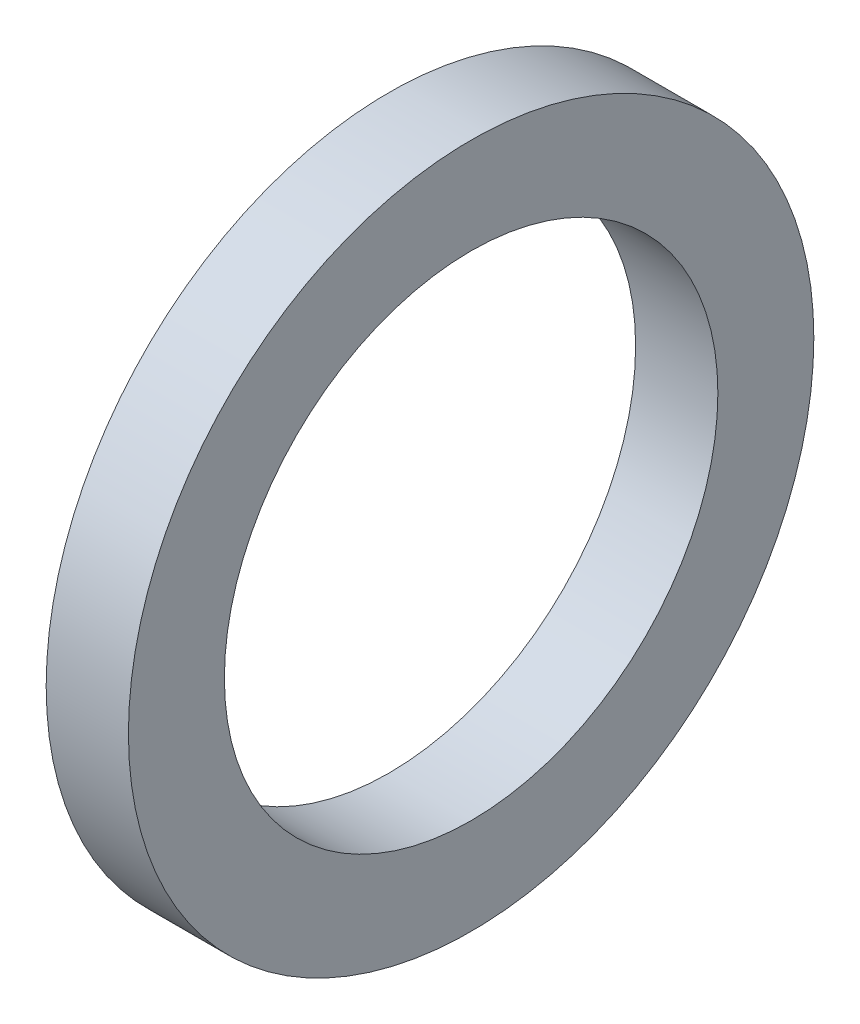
SolidWorks part; units mm, degrees
ref_plane "Plane1" through (0, 0, 0) normal (0, 0, 1) x (1, 0, 0)
ref_plane "Plane2" through (0, 0, 0) normal (0, 1, 0) x (1, 0, 0)
ref_plane "Plane3" through (0, 0, 0) normal (1, 0, 0) x (0, 0, -1)
other "Configuration Table"
sketch "Sketch1" plane through (0, 0, 0) normal (0, 0, 1) x (1, 0, 0)
  line L0 (-34.925, 0) -> (9.525, 0) construction
  line L1 (0, 18) -> (0, 25)
  line L2 (0, 25) -> (-6, 25)
  line L3 (-6, 25) -> (-6, 18)
  line L4 (-6, 18) -> (0, 18)
  dimension "Thickness" = 6
  dimension "Inside_dia" = 36
  dimension "Outside_dia" = 50
revolve "Base-Revolve" add sketch "Sketch1" angle 360 about L0
